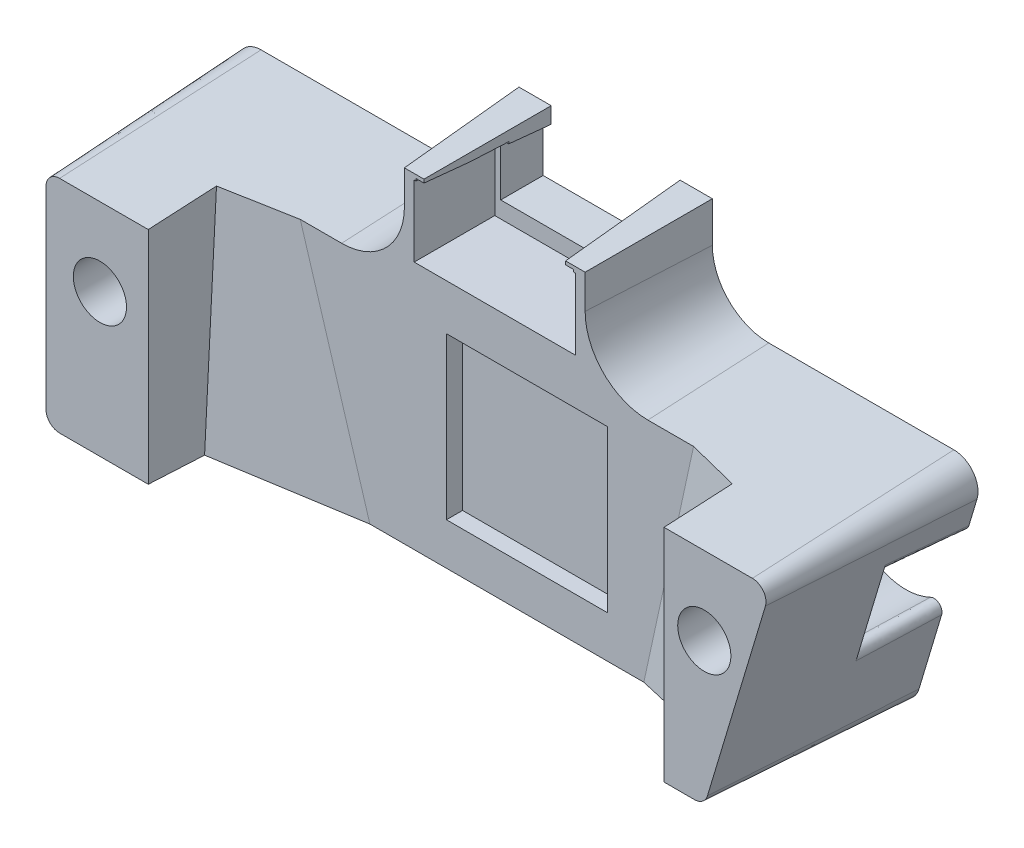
SolidWorks part; units mm, degrees
ref_plane "Plan1" through (0, 0, 0) normal (0, 0, 1) x (1, 0, 0)
ref_plane "Plan2" through (0, 0, 0) normal (0, 1, 0) x (1, 0, 0)
ref_plane "Plan3" through (0, 0, 0) normal (1, 0, 0) x (0, 0, -1)
sketch "Esquisse2" plane through (0, 0, 0) normal (0, 0, 1) x (1, 0, 0)
  line L0 (91.8414, 26.138) -> (84.6414, 2.138)
  line L1 (3, 0) -> (81.7679, 0)
  line L2 (0, 3) -> (0, 27)
  line L3 (3, 30) -> (28, 30)
  line L4 (66, 30) -> (88.9679, 30)
  line L5 (55, 42) -> (59, 42)
  line L6 (35, 37) -> (35, 42)
  line L7 (35, 42) -> (39, 42)
  line L8 (59, 37) -> (59, 42)
  line L9 (56, 34) -> (38, 34)
  line L10 (56, 34) -> (56, 40)
  line L11 (56, 40) -> (55, 40)
  line L12 (38, 34) -> (38, 40)
  line L14 (55, 40) -> (55, 42)
  line L15 (39, 40) -> (38, 40)
  line L16 (39, 40) -> (39, 42)
  arc A0 (35, 37) -> (28, 30) centre (28, 37) cw
  arc A1 (59, 37) -> (66, 30) centre (66, 37) ccw
  arc A2 (3, 30) -> (0, 27) centre (3, 27) ccw
  arc A3 (91.8414, 26.138) -> (88.9679, 30) centre (88.9679, 27) ccw
  arc A4 (81.7679, 0) -> (84.6414, 2.138) centre (81.7679, 3) ccw
  arc A5 (0, 3) -> (3, 0) centre (3, 3) ccw
  point P23 (0, 30)
  point P26 (93, 30)
  point P29 (84, 0)
  point P32 (0, 0)
  dimension "D13" = 7
  dimension "D14" = 3
  dimension "D15" = 3
  dimension "D1" = 93
  dimension "D2" = 84
  dimension "D3" = 30
  dimension "D4" = 4
  dimension "D5" = 3
  dimension "D6" = 3
  dimension "D7" = 2
  dimension "D8" = 1
  dimension "D9" = 1
  dimension "D10" = 6
  dimension "D11" = 24
  dimension "D12" = 35
extrude "Base-Extrusion" add sketch "Esquisse2" along normal blind 25 draft 3
sketch "Esquisse3" plane through (0, 0, 25) normal (0, 0, 1) x (1, 0, 0)
  line L0 (36.6898, 32.6898) -> (36.6898, 40.6898) construction
  line L1 (37, 31.6898) -> (57, 31.6898)
  line L2 (37, 31.6898) -> (37, 40.5)
  line L3 (57, 40.5) -> (37, 40.5)
  line L4 (57, 31.6898) -> (57, 40.5)
  line L6 (56, 40) -> (56, 34) construction
  line L7 (57.3102, 32.6898) -> (36.6898, 32.6898) construction
  line L8 (35, 42) -> (35, 37) construction
  line L9 (39, 42) -> (35, 42) construction
  line L10 (59, 42) -> (55, 42) construction
  line L11 (47, 32.6898) -> (47, 47.4496) construction
  dimension "D1" = 20
  dimension "D3" = 1
  dimension "D4" = 1.5
extrude "Enlèv. mat.-Extru.1" cut sketch "Esquisse3" against normal blind 20
sketch "Esquisse4" plane through (0, 0, 25) normal (0, 0, 1) x (1, 0, 0)
  line L0 (0, -50) -> (0, 50) construction
  line L1 (14, 63.9462) -> (78, 63.9462)
  line L2 (14, 63.9462) -> (14, -20.6049)
  line L3 (14, -20.6049) -> (78, -20.6049)
  line L4 (78, 63.9462) -> (78, -20.6049)
  dimension "D1" = 64
  dimension "D2" = 14
extrude "Enlèv. mat.-Extru.2" cut sketch "Esquisse4" against normal blind 10
sketch "Esquisse5" plane through (0, 0, 0) normal (0, -0.9986, 0.0523) x (1, 0, 0)
  line L0 (78, 18.0343) -> (65.5, 15.0206)
  line L1 (14, 15.0206) -> (31.5, 15.0206)
  line L2 (14, 15.0206) -> (14, 18.0343)
  line L5 (78, 15.0206) -> (65.5, 15.0206)
  line L6 (78, 15.0206) -> (78, 18.0343)
  line L9 (14, 18.0343) -> (31.5, 15.0206)
  dimension "D1" = 12.5
  dimension "D2" = 17.5
  dimension "D3" = 7
extrude "Boss.-Extru.1" add sketch "Esquisse5" along normal up to surface (28.5452 mm away)
sketch "Esquisse6" plane through (0, 0, 15) normal (0, 0, 1) x (1, 0, 0)
  line L0 (0, -50) -> (0, 50) construction
  line L1 (41, 26) -> (61, 26)
  line L2 (41, 26) -> (41, 6)
  line L3 (41, 6) -> (61, 6)
  line L4 (61, 26) -> (61, 6)
  line L7 (50, 0) -> (-50, 0) construction
  dimension "D1" = 41
  dimension "D2" = 20
  dimension "D3" = 20
  dimension "D4" = 6
extrude "Enlèv. mat.-Extru.3" cut sketch "Esquisse6" against normal blind 2
hole_wizard "Perçage1" positions "Esquisse8" profile "Esquisse7" counterbore size "M6" standard "Ansi Métrique"
sketch "Esquisse8" plane through (0, 0, 0) normal (0, 0, -1) x (-1, 0, 0)
  line L0 (-3, 0) -> (-81.7679, 0) construction
  line L1 (0, 50) -> (0, -50) construction
  point P0 (-8, 19)
  dimension "D1" = 19
  dimension "D2" = 8
sketch "Esquisse7" plane through (8, 19, 0) normal (1, 0, 0) x (0, 1, 0)
  line L0 (0, 0) -> (0, 25)
  line L1 (0, 25) -> (3.3, 25)
  line L3 (3.3, 25) -> (3.3, 10)
  line L4 (3.3, 10) -> (7, 10)
  line L5 (7, 10) -> (7, 0)
  line L7 (7, 0) -> (0, 0)
  line L11 (0, -6.35) -> (0, 107.95) construction
  dimension "Diamètre du perçage jusqu'au prochain" = 6.6
  dimension "Profondeur du perçage jusqu'au prochain" = 25
  dimension "Diamètre du chambrage" = 14
  dimension "Profondeur du chambrage" = 10
hole_wizard "Perçage2" positions "Esquisse10" profile "Esquisse9" counterbore size "M6" standard "Ansi Métrique"
sketch "Esquisse10" plane through (0, 0, 0) normal (0, 0, -1) x (-1, 0, 0)
  line L1 (-3, 0) -> (-81.7679, 0) construction
  circle A2 centre (-8, 19) radius 7 construction
  point P0 (-83, 19)
  dimension "D2" = 75
  dimension "D1" = 19
sketch "Esquisse9" plane through (83, 19, 0) normal (1, 0, 0) x (0, 1, 0)
  line L0 (0, 0) -> (0, 25)
  line L1 (0, 25) -> (3.3, 25)
  line L3 (3.3, 25) -> (3.3, 10)
  line L4 (3.3, 10) -> (7, 10)
  line L5 (7, 10) -> (7, 0)
  line L7 (7, 0) -> (0, 0)
  line L11 (0, -6.35) -> (0, 107.95) construction
  dimension "Diamètre du perçage jusqu'au prochain" = 6.6
  dimension "Profondeur du perçage jusqu'au prochain" = 25
  dimension "Diamètre du chambrage" = 14
  dimension "Profondeur du chambrage" = 10
fillet "Congé1" radius 1
fillet "Congé2" radius 1
